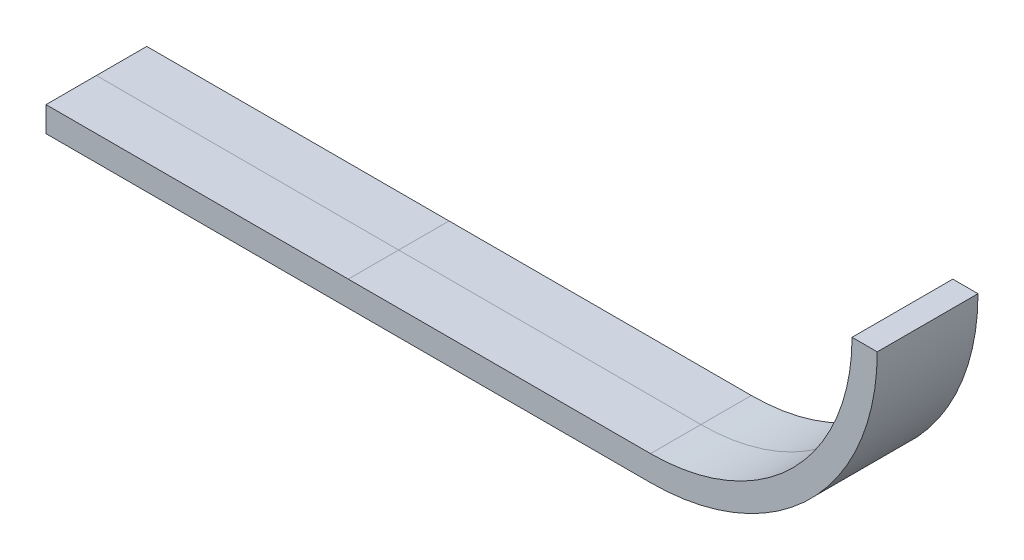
SolidWorks part; units mm, degrees
ref_plane "Front" through (0, 0, 0) normal (0, 0, 1) x (1, 0, 0)
ref_plane "Top" through (0, 0, 0) normal (0, 1, 0) x (1, 0, 0)
ref_plane "Right" through (0, 0, 0) normal (1, 0, 0) x (0, 0, -1)
sketch3d "3DSketch2"
  point P0 (56.0605, 10.6145, 6.35)
  point P1 (38.1, 3.175, 6.35)
  point P2 (0, 3.175, 6.35)
sketch "Sketch1" plane through (0, 0, 0) normal (0, 0, 1) x (1, 0, 0)
  line L0 (-38.1, 3.175) -> (-38.1, 0)
  line L1 (0, 82.7711) -> (0, -89.0896) construction
  line L3 (38.1, 3.175) -> (-38.1, 3.175)
  line L4 (38.1, 0) -> (-38.1, 0)
  line L7 (63.5, 28.575) -> (66.675, 28.575)
  arc A0 (38.1, 3.175) -> (63.5, 28.575) centre (38.1, 28.575) ccw
  arc A1 (38.1, 0) -> (66.675, 28.575) centre (38.1, 28.575) ccw
  dimension "D1" = 3.175
  dimension "D2" = 25.4
  dimension "D3" = 76.2
extrude "Extrude1" add sketch "Sketch1" along normal blind 12.7
ref_plane "Plane2" through (0, 31.115, 0) normal (0, 1, 0) x (-1, 0, 0)
sketch "Sketch4" plane through (0, 31.115, 0) normal (0, 1, 0) x (-1, 0, 0)
  line L0 (-66.675, 6.35) -> (38.1, 6.35)
  line L5 (-66.675, 12.7) -> (-66.675, 0) construction
  line L6 (38.1, 12.7) -> (38.1, 0) construction
sketch "Sketch5" plane through (0, 31.115, 0) normal (0, 1, 0) x (-1, 0, 0)
  line L3 (0, 12.7) -> (0, 0)
  line L4 (-38.1, 12.7) -> (38.1, 12.7) construction
sketch "Sketch6" plane through (0, 31.115, 0) normal (0, 1, 0) x (-1, 0, 0)
  line L0 (-56.0605, 6.35) -> (-56.0605, 12.7)
  line L1 (-38.1, 12.7) -> (-63.5, 12.7) construction
  line L2 (-56.0605, 6.35) -> (-56.0605, 0)
  line L3 (-63.5, 0) -> (-38.1, 0) construction
